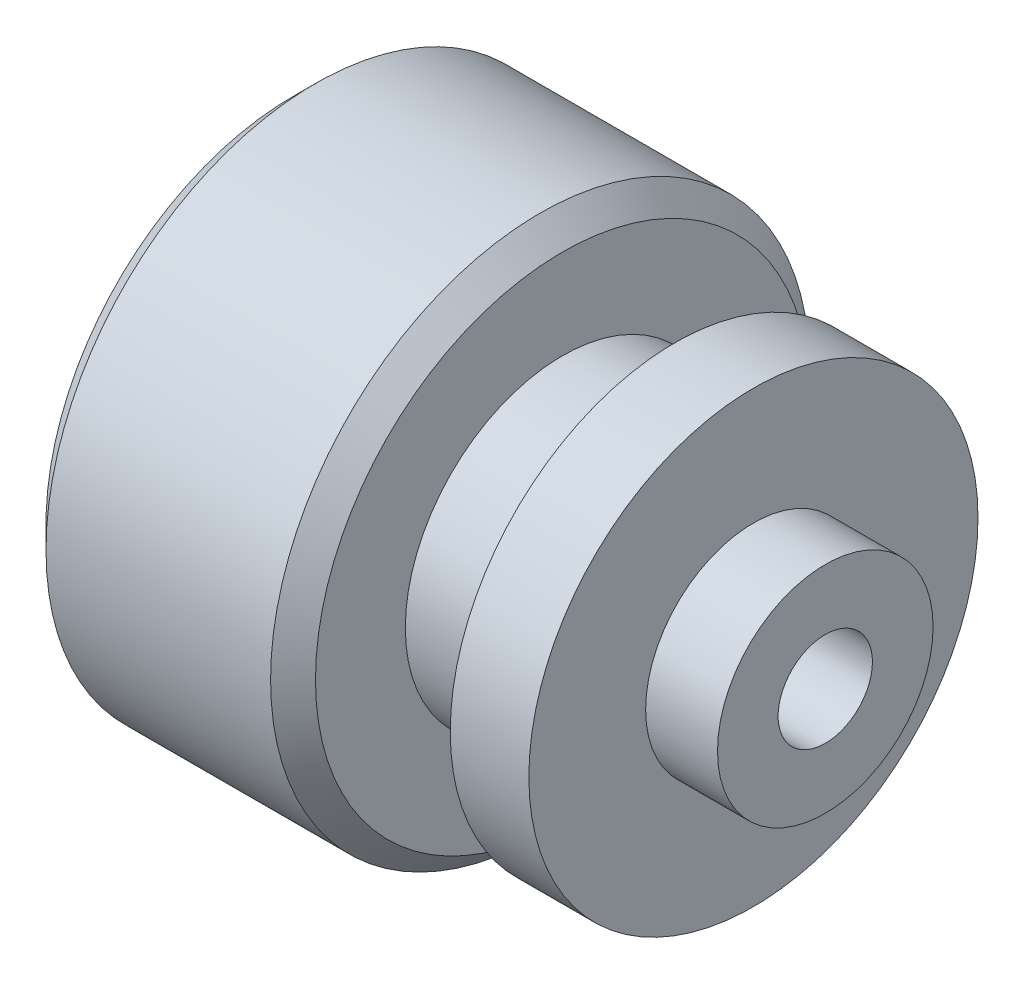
SolidWorks part; units mm, degrees
ref_plane "Front Plane" through (0, 0, 0) normal (0, 0, 1) x (1, 0, 0)
ref_plane "Top Plane" through (0, 0, 0) normal (0, 1, 0) x (1, 0, 0)
ref_plane "Right Plane" through (0, 0, 0) normal (1, 0, 0) x (0, 0, -1)
sketch "Sketch1" plane through (0, 0, 0) normal (0, 0, 1) x (1, 0, 0)
  line L0 (0, 0) -> (23.7, 0) construction
  line L1 (0, 0) -> (0, 12)
  line L2 (0, 12) -> (12, 12)
  line L3 (12, 12) -> (12, 7)
  line L4 (12, 7) -> (17, 7)
  line L5 (17, 7) -> (17, 10)
  line L6 (17, 10) -> (20.5, 10)
  line L7 (20.5, 10) -> (20.5, 4.8)
  line L8 (20.5, 4.8) -> (23.7, 4.8)
  line L9 (23.7, 4.8) -> (23.7, 0)
  line L10 (0, 0) -> (23.7, 0)
  dimension "D1" = 4.8
  dimension "D2" = 10
  dimension "D3" = 7
  dimension "D4" = 12
  dimension "D5" = 12
  dimension "D6" = 5
  dimension "D7" = 3.5
  dimension "D8" = 3.2
revolve "Revolve1" add sketch "Sketch1" angle 360 about L0
hole_wizard "M5 Tapped Hole1" positions "Sketch3" profile "Sketch2" tap size "M5" standard "ISO"
sketch "Sketch3" plane through (23.7, 0, 0) normal (1, 0, 0) x (0, 0, -1)
  point P1 (0, 0)
sketch "Sketch2" plane through (23.7, 0, 0) normal (0, 1, 0) x (0, 0, -1)
  line L0 (0, 0) -> (0, 23.7)
  line L1 (0, 23.7) -> (2.1, 23.7)
  line L2 (2.1, 23.7) -> (2.1, 0)
  line L5 (2.1, 0) -> (0, 0)
  line L11 (0, -6.35) -> (0, 107.95) construction
  dimension "Thru Tap Drill Dia." = 4.2
  dimension "Thru Tap Drill Depth" = 23.7
sketch "Sketch9" plane through (0, 0, 0) normal (-1, 0, 0) x (0, 0, 1)
  circle A0 centre (0, 0) radius 2.5
  dimension "D1" = 5
extrude "Extrude1" cut sketch "Sketch9" against normal blind 12
chamfer "Chamfer1" distance 1 angle 45 2 edges at (12, 0, 12) (0, 0, 12)
